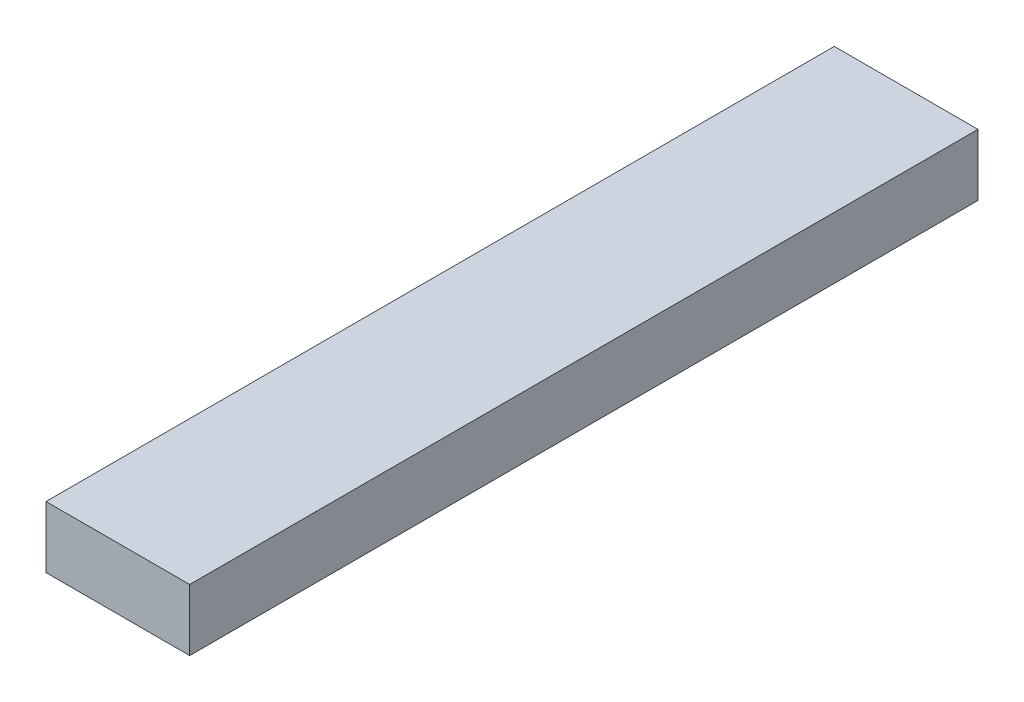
SolidWorks part; units mm, degrees
ref_plane "Front Plane" through (0, 0, 0) normal (1, 0, 0) x (0, 1, 0)
ref_plane "Top Plane" through (0, 0, 0) normal (0, 0, 1) x (0, 1, 0)
ref_plane "Right Plane" through (0, 0, 0) normal (0, 1, 0) x (-1, 0, 0)
sketch "Sketch1" plane through (0, 0, 0) normal (1, 0, 0) x (0, 1, 0)
  line L1 (-7.5, -96) -> (7.5, -96)
  line L2 (-7.5, -96) -> (-7.5, 96)
  line L3 (-7.5, 96) -> (7.5, 96)
  line L4 (7.5, -96) -> (7.5, 96)
  line L5 (-7.5, -96) -> (7.5, 96) construction
  line L6 (-7.5, 96) -> (7.5, -96) construction
  point P0 (0, 0)
  dimension "D1" = 192
  dimension "D2" = 15
extrude "Boss-Extrude1" add sketch "Sketch1" along normal blind 35
